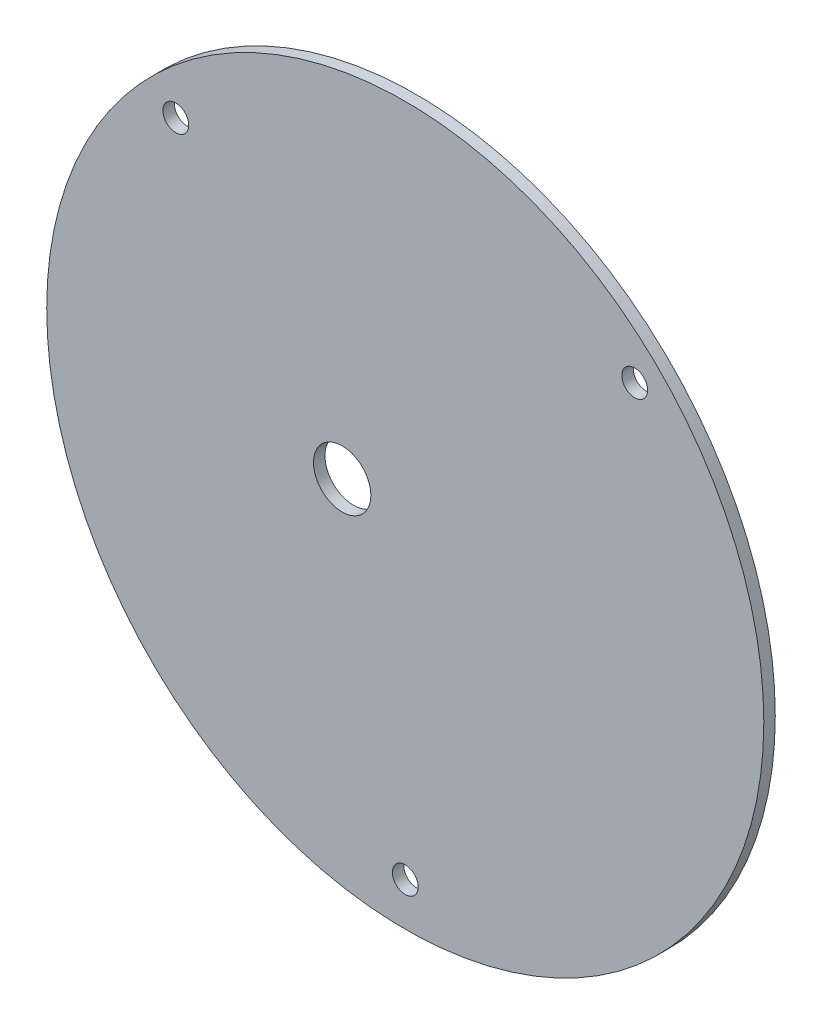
SolidWorks part; units mm, degrees
ref_plane "Piano frontale" through (0, 0, 0) normal (0, 0, 1) x (1, 0, 0)
ref_plane "Piano superiore" through (0, 0, 0) normal (0, 1, 0) x (1, 0, 0)
ref_plane "Piano destro" through (0, 0, 0) normal (1, 0, 0) x (0, 0, -1)
sketch "Schizzo1" plane through (0, 0, 0) normal (0, 0, 1) x (1, 0, 0)
  circle A0 centre (0, 0) radius 125
  circle A1 centre (80, 80) radius 4.5
  circle A2 centre (-80, 80) radius 4.5
  circle A3 centre (0, -110) radius 4.5
  circle A4 centre (-22, 0) radius 10
  dimension "D1" = 250
  dimension "D5" = 9
  dimension "D6" = 9
  dimension "D7" = 9
  dimension "D8" = 80
  dimension "D10" = 20
  dimension "D2" = 80
  dimension "D3" = 80
  dimension "D4" = 110
  dimension "D9" = 80
  dimension "D11" = 22
extrude "Estrusione-Estrusione1" add sketch "Schizzo1" along normal blind 4
